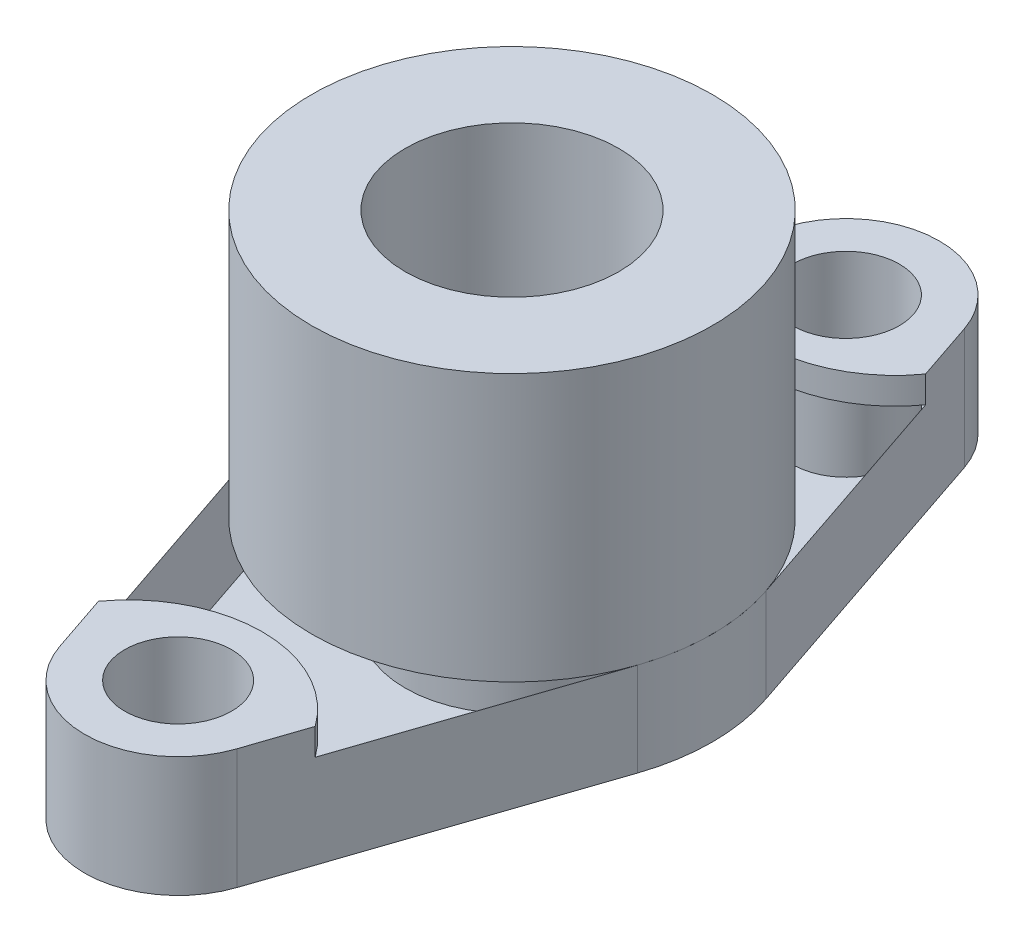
SolidWorks part; units mm, degrees
ref_plane "前视基准面" through (0, 0, 0) normal (0, 0, 1) x (1, 0, 0)
ref_plane "上视基准面" through (0, 0, 0) normal (0, 1, 0) x (1, 0, 0)
ref_plane "右视基准面" through (0, 0, 0) normal (1, 0, 0) x (0, 0, -1)
sketch "草图1" plane through (0, 0, 0) normal (0, 1, 0) x (1, 0, 0)
  circle A0 centre (0, 0) radius 15
  circle A1 centre (0, 0) radius 8
extrude "拉伸1" add sketch "草图1" along normal blind 27
sketch "草图2" plane through (0, 0, 0) normal (0, -1, 0) x (1, 0, 0)
  line L0 (0, 0) -> (0, -40.2281) construction
  line L1 (14.2113, -4.8) -> (6.6319, -27.24)
  line L2 (-14.2113, -4.8) -> (-6.6319, -27.24)
  line L3 (14.2113, 4.8) -> (6.6319, 27.24)
  line L4 (-6.6319, 27.24) -> (-14.2113, 4.8)
  arc A0 (14.2113, -4.8) -> (14.2113, 4.8) centre (0, 0) ccw
  arc A1 (-6.6319, -27.24) -> (6.6319, -27.24) centre (0, -25) ccw
  arc A2 (6.6319, 27.24) -> (-6.6319, 27.24) centre (0, 25) ccw
  arc A3 (-14.2113, 4.8) -> (-14.2113, -4.8) centre (0, 0) ccw
  circle A4 centre (0, -25) radius 4
  circle A5 centre (0, 25) radius 4
  circle A6 centre (0, 0) radius 8
  dimension "D1" = 14
  dimension "D2" = 14
extrude "拉伸2" add sketch "草图2" against normal blind 7
sketch "草图3" plane through (0, 7, 0) normal (0, 1, 0) x (-1, 0, 0)
  line L0 (-6.6319, -27.24) -> (-8.1144, -22.8508)
  line L3 (6.6319, -27.24) -> (8.1144, -22.8508)
  line L7 (-14.2113, 4.8) -> (-6.6319, 27.24) construction
  line L8 (0, 0) -> (24.3231, 0) construction
  line L9 (6.6319, 27.24) -> (14.2113, 4.8) construction
  line L10 (6.6319, 27.24) -> (8.1144, 22.8508)
  line L11 (-6.6319, 27.24) -> (-8.1144, 22.8508)
  arc A2 (-8.1144, -22.8508) -> (8.1144, -22.8508) centre (0, -28.6951) cw
  circle A3 centre (0, -25) radius 4
  arc A4 (-6.6319, 27.24) -> (6.6319, 27.24) centre (0, 25) cw
  circle A5 centre (0, 25) radius 4
  arc A6 (-8.1144, 22.8508) -> (8.1144, 22.8508) centre (0, 28.6951) ccw
  arc A7 (-6.6319, -27.24) -> (6.6319, -27.24) centre (0, -25) ccw
extrude "拉伸3" add sketch "草图3" along normal blind 2
